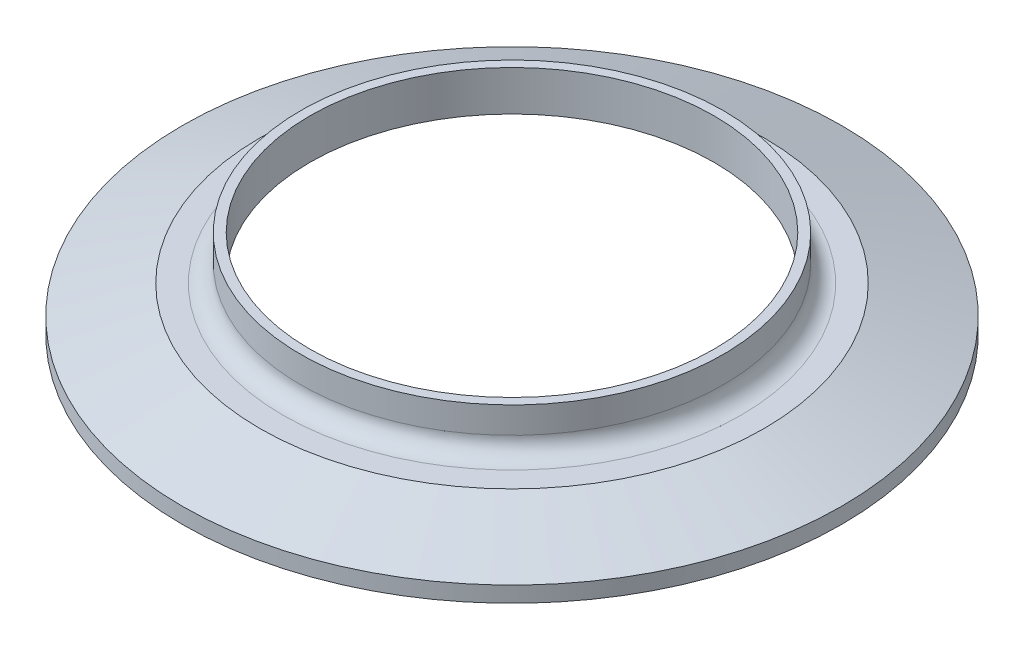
SolidWorks part; units mm, degrees
ref_plane "Front Plane" through (0, 0, 0) normal (0, 0, 1) x (1, 0, 0)
ref_plane "Top Plane" through (0, 0, 0) normal (0, 1, 0) x (1, 0, 0)
ref_plane "Right Plane" through (0, 0, 0) normal (1, 0, 0) x (0, 0, -1)
sketch "Sketch1" plane through (0, 0, 0) normal (0, 0, 1) x (1, 0, 0)
  line L0 (0, 0) -> (0, 8.8532) construction
  line L1 (-38.1, 15.875) -> (-38.1, 11.1252)
  line L2 (-41.275, 7.9502) -> (-45.4344, 7.9502)
  line L3 (-45.4344, 7.9502) -> (-59.4614, 2.8448)
  line L4 (-59.4614, 2.8448) -> (-59.4614, 0)
  line L5 (-59.4614, 0) -> (-56.9249, 0)
  line L6 (-48.6918, 0) -> (-52.8099, 0)
  line L10 (-48.6918, 0) -> (-36.449, 8.6044)
  line L11 (-36.449, 8.6044) -> (-36.449, 15.875)
  line L12 (-36.449, 15.875) -> (-38.1, 15.875)
  line L15 (-55.8994, 0.8729) -> (-56.0708, 0.4691)
  line L17 (-53.7016, 0.8729) -> (-53.5347, 0.4797)
  arc A0 (-41.275, 7.9502) -> (-38.1, 11.1252) centre (-41.275, 11.1252) ccw
  arc A1 (-56.0708, 0.4691) -> (-56.9249, 0) centre (-56.7956, 0.7767) cw
  arc A2 (-52.8099, 0) -> (-53.5347, 0.4797) centre (-52.8099, 0.7874) cw
  arc A3 (-53.7016, 0.8729) -> (-55.8994, 0.8729) centre (-54.8005, 0.4064) ccw
  dimension "D3" = 3.175
  dimension "D7" = 0.7874
  dimension "D8" = 54.8005
  dimension "D9" = 0.7874
  dimension "D15" = 1.1938
  dimension "D2" = 36.449
  dimension "D4" = 15.875
  dimension "D5" = 7.9502
  dimension "D6" = 59.4614
  dimension "D10" = 20
  dimension "D11" = 48.6918
  dimension "D12" = 38.1
  dimension "D13" = 2.8448
  dimension "D14" = 54.9
  dimension "D16" = 0.4064
  dimension "D17" = 46
  dimension "D18" = 2.8448
revolve "Revolve1" add sketch "Sketch1" angle 360 about L0
